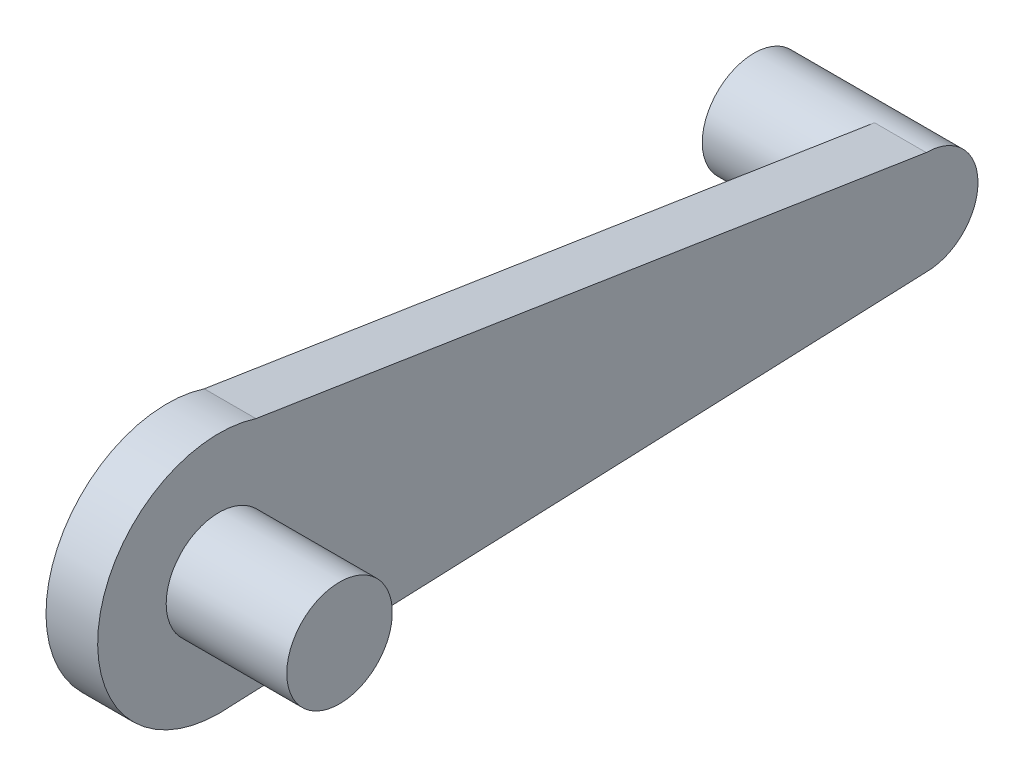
SolidWorks part; units mm, degrees
ref_plane "Front Plane" through (0, 0, 0) normal (0, 0, 1) x (1, 0, 0)
ref_plane "Top Plane" through (0, 0, 0) normal (0, 1, 0) x (1, 0, 0)
ref_plane "Right Plane" through (0, 0, 0) normal (1, 0, 0) x (0, 0, -1)
sketch "Sketch2" plane through (0, 0, 0) normal (-1, 0, 0) x (0, 0, 1)
  circle A0 centre (-10.441, 10.7767) radius 3.0636
extrude "Boss-Extrude3" add sketch "Sketch2" along normal blind 7
sketch "Sketch4" plane through (-7, 0, 0) normal (-1, 0, 0) x (0, 0, 1)
  circle A0 centre (-10.441, 10.7767) radius 7.0415
extrude "Boss-Extrude5" add sketch "Sketch4" along normal blind 3
sketch "Sketch9" plane through (-7, 0, 0) normal (-1, 0, 0) x (0, 0, 1)
  circle A0 centre (-51.5013, 8.3995) radius 3.0035
extrude "Boss-Extrude7" add sketch "Sketch9" along normal blind 3
sketch "Sketch10" plane through (-10, 0, 0) normal (-1, 0, 0) x (0, 0, 1)
  line L0 (-10.441, 17.8183) -> (-51.5013, 11.403)
  line L1 (-51.5013, 11.403) -> (-51.5013, 5.396)
  line L2 (-51.5013, 5.396) -> (-10.441, 3.7352)
  line L3 (-10.441, 3.7352) -> (-10.441, 17.8183)
  circle A0 centre (-10.441, 10.7767) radius 7.0415 construction
  circle A1 centre (-51.5013, 8.3995) radius 3.0035 construction
extrude "Boss-Extrude8" add sketch "Sketch10" against normal blind 3
sketch "Sketch11" plane through (-10, 0, 0) normal (-1, 0, 0) x (0, 0, 1)
  line L0 (-51.5013, 11.403) -> (-51.5013, 5.396) construction
  circle A0 centre (-51.5013, 8.3995) radius 3.0035
extrude "Boss-Extrude9" add sketch "Sketch11" along normal blind 7
scale "Scale1" scale about centroid uniform scaling yes scale factor 3.863227
